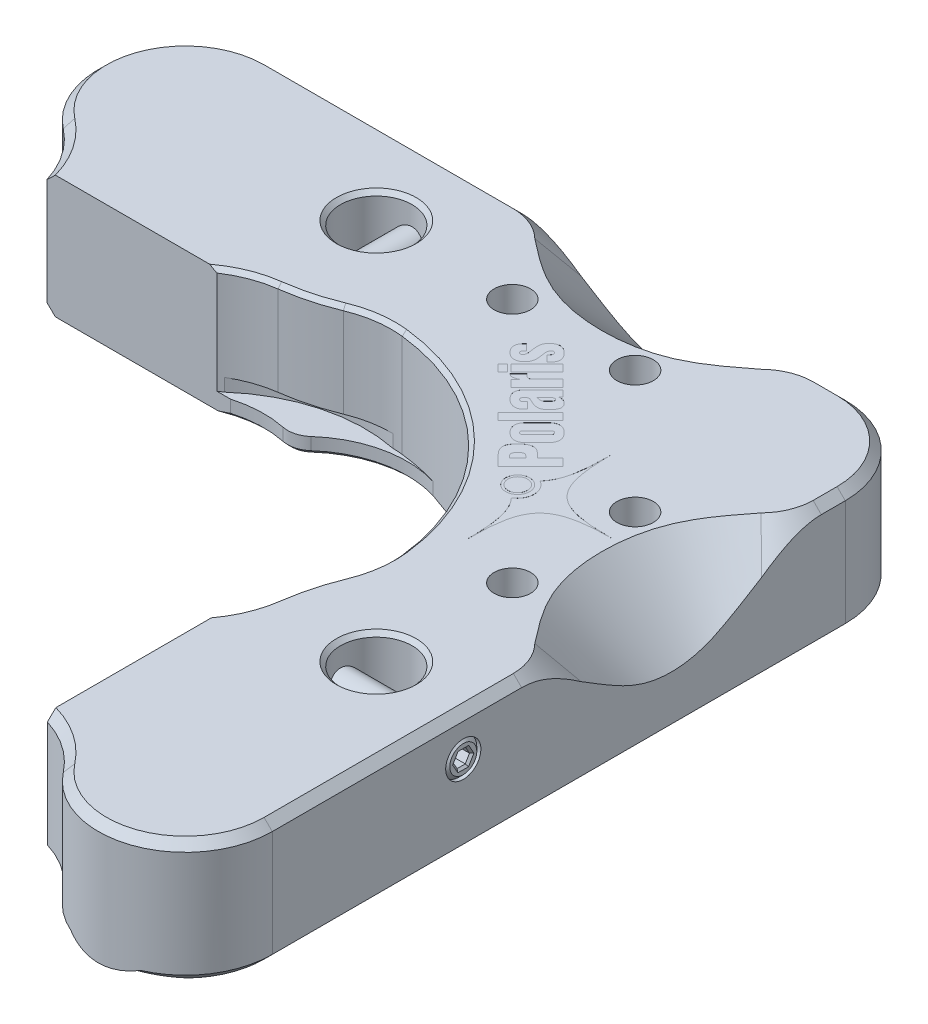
SolidWorks part; units mm, degrees
ref_plane "Front Plane" through (0, 0, 0) normal (0, 0, 1) x (1, 0, 0)
ref_plane "Top Plane" through (0, 0, 0) normal (0, 1, 0) x (1, 0, 0)
ref_plane "Right Plane" through (0, 0, 0) normal (1, 0, 0) x (0, 0, -1)
imported_body "SS2S031-1-2-solid1"
imported_body "SS2S031-1-3-solid1"
imported_body "TTN234144-1-solid1"
imported_body "W4MH02S-1-solid1"
imported_body "W4MH02S-2-solid1"
imported_body "W4MH02S-3-solid1"
imported_body "W4MH02S-4-solid1"
imported_body "W4MH02S-5-solid1"
imported_body "W4MH02S-6-solid1"
imported_body "SS4AR019-1-1-solid1"
hole_wizard "#4-40 Tapped Hole1" positions "Sketch3" profile "Sketch4" tap size "#4-40" standard "ANSI Inch"
sketch "Sketch3" plane through (0, 9.525, 0) normal (0, -1, 0) x (-1, 0, 0)
  point P0 (7.62, 0)
  point P2 (15.24, 0)
  point P6 (0, -7.62)
  point P8 (0, -15.24)
  point P11 (0, 0)
  point P12 (0, 0)
  dimension "D1" = 7.62
  dimension "D2" = 7.62
  dimension "D3" = 7.62
  dimension "D4" = 7.62
sketch "Sketch4" plane through (-7.62, 9.525, 0) normal (1, 0, 0) x (0, 0, -1)
  line L0 (0, 0) -> (0, 7.7739)
  line L1 (0, 7.7739) -> (1.1303, 7.7739)
  line L2 (1.1303, 7.7739) -> (1.1303, 0)
  line L5 (1.1303, 0) -> (0, 0)
  line L11 (0, -6.35) -> (0, 107.95) construction
  dimension "Thru Tap Drill Dia." = 2.2606
  dimension "Thru Tap Drill Depth" = 7.7739
sketch "Sketch5" plane through (0, 17.145, 0) normal (0, 1, 0) x (1, 0, 0)
  line L1 (-45.179, -7.5032) -> (-21.2074, -7.5032)
  line L2 (-45.179, -7.5032) -> (-45.179, -43.1854)
  line L3 (-45.179, -43.1854) -> (-21.2074, -43.1854)
  line L4 (-21.2074, -7.5032) -> (-21.2074, -43.1854)
  line L5 (-7.4609, -21.5085) -> (-22.2066, -21.5085)
  line L6 (-7.4609, -21.5085) -> (-7.4609, -43.1854)
  line L7 (-7.4609, -43.1854) -> (-22.2066, -43.1854)
  line L8 (-22.2066, -21.5085) -> (-22.2066, -43.1854)
  arc A0 (-14.5081, -5.6486) -> (-20.714, -7.0124) centre (-16.3996, -11.8432) ccw construction
  arc A1 (-6.8229, -20.8832) -> (-5.4056, -14.4339) centre (-11.8432, -16.3996) ccw construction
  arc A2 (-14.5081, -5.6486) -> (-20.714, -7.0124) centre (-16.3996, -11.8432) ccw construction
  point P14 (0, 0)
  point P15 (-19.2333, -6.019)
  point P19 (0, 0)
  point P20 (-21.2074, -7.5032)
extrude "Cut-Extrude3" cut sketch "Sketch5" against normal through all contours L8 L5 L4 L1 L2 L3 | L5 L8 L3 L4 | L7 L6 L5 L4
